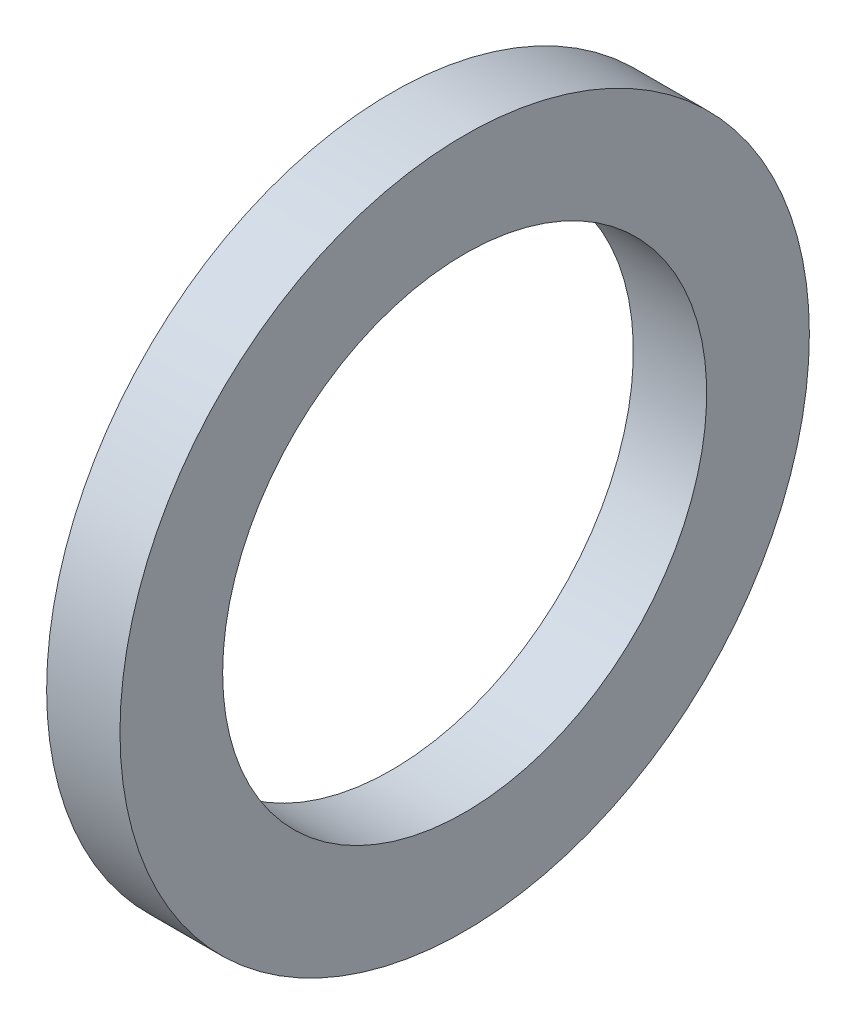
SolidWorks part; units mm, degrees
ref_plane "Plane1" through (0, 0, 0) normal (0, 0, 1) x (1, 0, 0)
ref_plane "Plane2" through (0, 0, 0) normal (0, 1, 0) x (1, 0, 0)
ref_plane "Plane3" through (0, 0, 0) normal (1, 0, 0) x (0, 0, -1)
sketch "Sketch1" plane through (0, 0, 0) normal (0, 0, 1) x (1, 0, 0)
  line L0 (-34.925, 0) -> (9.525, 0) construction
  line L1 (0, 16.5) -> (0, 23.5)
  line L2 (0, 23.5) -> (-5, 23.5)
  line L3 (-5, 23.5) -> (-5, 16.5)
  line L4 (-5, 16.5) -> (0, 16.5)
  dimension "Thickness" = 5
  dimension "Inside_dia" = 33
  dimension "Outside_dia" = 47
revolve "Base-Revolve" add sketch "Sketch1" angle 360 about L0
